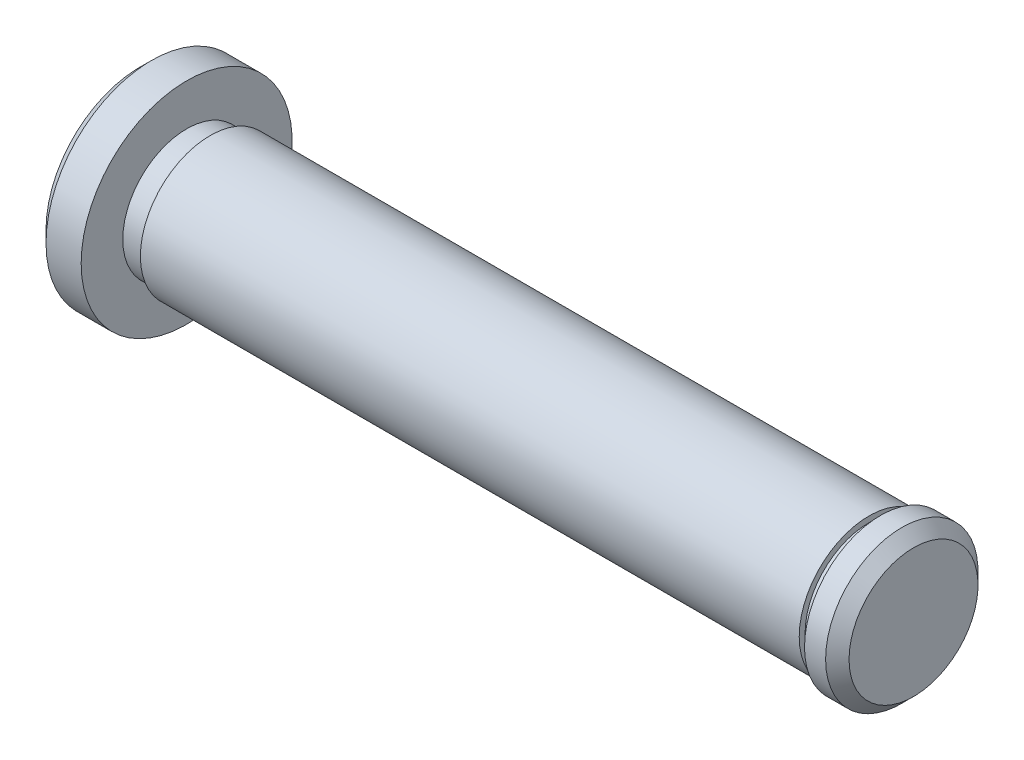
SolidWorks part; units mm, degrees
ref_plane "前视基准面" through (0, 0, 0) normal (0, 0, 1) x (1, 0, 0)
ref_plane "上视基准面" through (0, 0, 0) normal (0, 1, 0) x (1, 0, 0)
ref_plane "右视基准面" through (0, 0, 0) normal (1, 0, 0) x (0, 0, -1)
other "Configuration Table"
sketch "草图1" plane through (0, 0, 0) normal (0, 0, 1) x (1, 0, 0)
  line L0 (0, 0) -> (73.12, 0) construction
  line L2 (0, 0) -> (4, 0)
  line L3 (0, 0) -> (0, 9)
  line L4 (0, 9) -> (4, 9)
  line L5 (4, 0) -> (4, 9)
  line L6 (4, 0) -> (6, 0)
  line L7 (4, 0) -> (4, 5.45)
  line L8 (4, 5.45) -> (6, 5.45)
  line L9 (6, 0) -> (6, 5.45)
  line L10 (6, 0) -> (62.2, 0)
  line L11 (6, 0) -> (6, 5.95)
  line L12 (6, 5.95) -> (62.2, 5.95)
  line L13 (62.2, 0) -> (62.2, 5.95)
  line L14 (62.2, 0) -> (63.2, 0)
  line L15 (62.2, 0) -> (62.2, 5.45)
  line L16 (62.2, 5.45) -> (63.2, 5.45)
  line L17 (63.2, 0) -> (63.2, 5.45)
  line L18 (63.2, 0) -> (66, 0)
  line L19 (63.2, 0) -> (63.2, 6.5)
  line L20 (63.2, 6.5) -> (66, 6.5)
  line L21 (66, 0) -> (66, 6.5)
  dimension "D1" = 4
  dimension "D2" = 9
  dimension "D3" = 2
  dimension "D4" = 5.45
  dimension "D5" = 56.2
  dimension "D6" = 5.95
  dimension "D7" = 5.45
  dimension "D8" = 1
  dimension "D9" = 6.5
  dimension "D10" = 66
revolve "旋转1" add sketch "草图1" angle 360 about L10
chamfer "倒角1" distance 1 2 edges at (66, 0, 6.5) (0, 0, 9)
